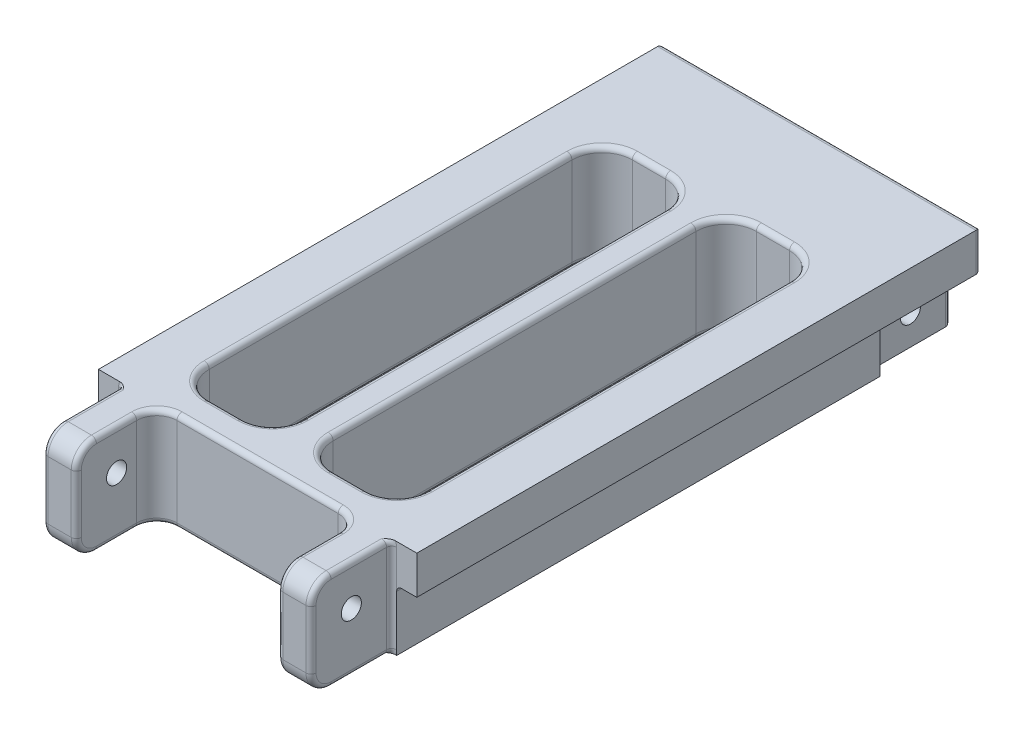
SolidWorks part; units mm, degrees
ref_plane "Front Plane" through (0, 0, 0) normal (0, 0, 1) x (1, 0, 0)
ref_plane "Top Plane" through (0, 0, 0) normal (0, 1, 0) x (1, 0, 0)
ref_plane "Right Plane" through (0, 0, 0) normal (1, 0, 0) x (0, 0, -1)
sketch "Sketch1" plane through (0, 0, 0) normal (0, 0, 1) x (1, 0, 0)
  line L24 (203.2, 0) -> (127, 0)
  line L25 (127, 0) -> (127, -76.2)
  line L26 (127, -76.2) -> (139.7, -76.2)
  line L27 (139.7, -76.2) -> (139.7, -101.6)
  line L28 (139.7, -101.6) -> (127, -101.6)
  line L29 (127, -101.6) -> (127, -139.7)
  line L30 (127, -139.7) -> (177.8, -139.7)
  line L31 (177.8, -139.7) -> (177.8, -101.6)
  line L32 (177.8, -101.6) -> (165.1, -101.6)
  line L33 (165.1, -101.6) -> (165.1, -76.2)
  line L34 (165.1, -76.2) -> (203.2, -76.2)
  line L35 (203.2, -76.2) -> (203.2, 0)
  line L36 (406.4, -76.2) -> (406.4, 0)
  line L37 (406.4, 0) -> (330.2, 0)
  line L38 (330.2, 0) -> (330.2, -76.2)
  line L39 (330.2, -76.2) -> (368.3, -76.2)
  line L40 (368.3, -76.2) -> (368.3, -101.6)
  line L41 (368.3, -101.6) -> (355.6, -101.6)
  line L42 (355.6, -101.6) -> (355.6, -139.7)
  line L43 (355.6, -139.7) -> (406.4, -139.7)
  line L44 (406.4, -139.7) -> (406.4, -101.6)
  line L45 (406.4, -101.6) -> (393.7, -101.6)
  line L46 (393.7, -101.6) -> (393.7, -76.2)
  line L47 (393.7, -76.2) -> (406.4, -76.2)
  line L48 (368.3, -76.2) -> (165.1, -76.2)
  line L49 (355.6, -139.7) -> (177.8, -139.7)
  line L50 (368.3, -74.93) -> (165.1, -74.93)
  line L51 (179.07, -139.7) -> (179.07, -100.33)
  line L52 (179.07, -100.33) -> (166.37, -100.33)
  line L53 (166.37, -100.33) -> (166.37, -76.2)
  line L54 (367.03, -76.2) -> (367.03, -100.33)
  line L55 (367.03, -100.33) -> (354.33, -100.33)
  line L56 (354.33, -100.33) -> (354.33, -139.7)
  line L57 (355.6, -138.43) -> (177.8, -138.43)
  dimension "D1" = 1.27
extrude "Boss-Extrude1" add sketch "Sketch1" against normal blind 406.4 contours L57 L56 L55 L54 L39 L48 L53 L52 L51
sketch "Sketch2" plane through (0, 0, 0) normal (0, 0, 1) x (1, 0, 0)
  line L0 (354.33, -138.43) -> (179.07, -138.43) construction
  line L1 (203.2, -138.43) -> (330.2, -138.43)
  line L2 (203.2, -138.43) -> (203.2, -76.2)
  line L3 (203.2, -76.2) -> (330.2, -76.2)
  line L4 (330.2, -138.43) -> (330.2, -76.2)
  line L5 (203.2, -138.43) -> (330.2, -76.2) construction
  line L6 (203.2, -76.2) -> (330.2, -138.43) construction
  line L7 (166.37, -76.2) -> (367.03, -76.2) construction
  line L8 (266.7, -138.43) -> (266.7, -76.2)
  line L9 (182.245, -138.43) -> (182.245, -76.2)
  line L10 (179.07, -138.43) -> (179.07, -100.33) construction
  line L11 (351.155, -138.43) -> (351.155, -76.2)
  point P4 (266.7, -107.315)
  dimension "D1" = 127
  dimension "D2" = 3.175
extrude "Cut-Extrude1" cut sketch "Sketch2" against normal blind 50.8 contours L8 L3 L2 M6 | L8 L1 L4 M10 | L11 M6 M7 M8 M9 M10 | L9 M6 M10 M11 M12 M13
sketch "Sketch3" plane through (330.2, 0, 0) normal (-1, 0, 0) x (0, 0, 1)
  line L2 (-50.8, -76.2) -> (0, -76.2) construction
  line L3 (0, -138.43) -> (0, -76.2) construction
  circle A0 centre (-25.4, -101.6) radius 6.35
  dimension "D1" = 12.7
  dimension "D2" = 25.4
  dimension "D3" = 25.4
extrude "Cut-Extrude2" cut sketch "Sketch3" against normal through all both and the other way through all
ref_plane "Plane1" through (266.7, 0, 0) normal (1, 0, 0) x (0, 0, -1)
sketch "Sketch4" plane through (266.7, 0, 0) normal (1, 0, 0) x (0, 0, -1)
  line L1 (406.4, -100.33) -> (381, -100.33)
  line L2 (406.4, -100.33) -> (406.4, -176.53)
  line L3 (406.4, -176.53) -> (381, -176.53)
  line L4 (381, -100.33) -> (381, -176.53)
  line L5 (406.4, -100.33) -> (381, -176.53) construction
  line L6 (406.4, -176.53) -> (381, -100.33) construction
  line L7 (406.4, -76.2) -> (50.8, -76.2) construction
  line L8 (361.95, -119.38) -> (361.95, -161.588)
  line L9 (361.95, -161.588) -> (381, -161.588)
  line L10 (381, -100.33) -> (420.5453, -100.33)
  line L11 (420.5453, -100.33) -> (395.8968, -131.2538)
  circle A0 centre (381, -119.38) radius 19.05
  point P4 (393.7, -138.43)
  dimension "D3" = 38.1
  dimension "D1" = 76.2
  dimension "D2" = 25.4
  dimension "D4" = 25.4
  dimension "D6" = 30.9238
extrude "Cut-Extrude3" cut sketch "Sketch4" against normal mid plane 127 contours L4 A0 | L2 A0 L4 | A0 L2 L1 | A0 L4 L3 L2 | A0 L8 L9 L4 | A0 L1 L2 L11 L10
sketch "Sketch5" plane through (0, -138.43, 0) normal (0, -1, 0) x (1, 0, 0)
  line L0 (179.07, -406.4) -> (179.07, -50.8) construction
  line L1 (185.42, -355.6) -> (347.98, -355.6)
  line L2 (185.42, -355.6) -> (185.42, -426.006)
  line L3 (185.42, -426.006) -> (347.98, -426.006)
  line L4 (347.98, -355.6) -> (347.98, -426.006)
  line L5 (185.42, -355.6) -> (347.98, -426.006) construction
  line L6 (185.42, -426.006) -> (347.98, -355.6) construction
  line L7 (354.33, -406.4) -> (354.33, -50.8) construction
  line L8 (203.2, -406.4) -> (179.07, -406.4) construction
  line L9 (125.262, -355.6) -> (402.4883, -355.6)
  line L10 (125.262, -355.6) -> (125.262, -438.4648)
  line L11 (125.262, -438.4648) -> (402.4883, -438.4648)
  line L12 (402.4883, -355.6) -> (402.4883, -438.4648)
  line L13 (125.262, -355.6) -> (402.4883, -438.4648) construction
  line L14 (125.262, -438.4648) -> (402.4883, -355.6) construction
  point P4 (266.7, -390.803)
  point P13 (263.8751, -397.0324)
  dimension "D1" = 6.35
  dimension "D2" = 6.35
  dimension "D3" = 50.8
extrude "Cut-Extrude5" cut sketch "Sketch5" along normal up to surface (38.1 mm away) contours L12 L9 L4 L3 L2 L10 L11 M9 M8 M20 M19 | L9 L4 M8 M9 | L9 L2 M19 M20
sketch "Sketch6" plane through (185.42, 0, 0) normal (-1, 0, 0) x (0, 0, 1)
  line L2 (-406.4, -100.33) -> (-381, -100.33) construction
  line L6 (-406.4, -100.33) -> (-381, -100.33)
  circle A1 centre (-381, -119.38) radius 19.05 construction
  circle A2 centre (-381, -119.38) radius 19.05
  circle A3 centre (-381, -119.38) radius 6.35
  dimension "D1" = 12.7
extrude "Cut-Extrude6" cut sketch "Sketch6" against normal blind 327.406 contours A3 | A2
fillet "Fillet1" radius 12.7 6 edges at (330.2, -107.315, -50.8) (203.2, -107.315, -50.8) (192.7225, -76.2, 0) (340.6775, -76.2, 0) (340.6775, -138.43, 0) (192.7225, -138.43, 0)
sketch "Sketch7" plane through (0, -138.43, 0) normal (0, -1, 0) x (1, 0, 0)
  line L0 (198.12, -50.8) -> (198.12, -355.6)
  line L1 (335.28, -355.6) -> (335.28, -50.8)
  line L2 (198.12, -355.6) -> (335.28, -355.6)
  line L3 (266.7, -355.6) -> (266.7, -50.8)
  line L4 (276.225, -355.6) -> (276.225, -50.8)
  line L5 (257.175, -355.6) -> (257.175, -50.8)
  line L6 (198.12, -336.55) -> (335.28, -336.55)
  line L7 (198.12, -50.8) -> (335.28, -50.8)
  line L8 (198.12, -69.85) -> (335.28, -69.85)
  line L20 (351.155, -50.8) -> (351.155, -12.7)
  line L21 (351.155, -12.7) -> (330.2, -12.7)
  line L22 (330.2, -12.7) -> (330.2, -38.1)
  line L23 (317.5, -50.8) -> (215.9, -50.8)
  line L24 (203.2, -38.1) -> (203.2, -12.7)
  line L25 (203.2, -12.7) -> (182.245, -12.7)
  line L26 (182.245, -12.7) -> (182.245, -50.8)
  line L27 (182.245, -50.8) -> (179.07, -50.8)
  line L28 (179.07, -50.8) -> (179.07, -355.6)
  line L29 (179.07, -355.6) -> (185.42, -355.6)
  line L30 (185.42, -355.6) -> (185.42, -406.4)
  line L31 (185.42, -406.4) -> (203.2, -406.4)
  line L32 (203.2, -406.4) -> (203.2, -361.95)
  line L33 (203.2, -361.95) -> (330.2, -361.95)
  line L34 (330.2, -361.95) -> (330.2, -406.4)
  line L35 (330.2, -406.4) -> (347.98, -406.4)
  line L36 (347.98, -406.4) -> (347.98, -355.6)
  line L37 (347.98, -355.6) -> (354.33, -355.6)
  line L38 (354.33, -355.6) -> (354.33, -50.8)
  line L39 (354.33, -50.8) -> (351.155, -50.8)
  line L40 (351.155, -50.8) -> (351.155, -12.7)
  line L41 (351.155, -12.7) -> (330.2, -12.7)
  line L42 (330.2, -12.7) -> (330.2, -38.1)
  line L43 (317.5, -50.8) -> (215.9, -50.8)
  line L44 (203.2, -38.1) -> (203.2, -12.7)
  line L45 (203.2, -12.7) -> (182.245, -12.7)
  line L46 (182.245, -12.7) -> (182.245, -50.8)
  line L47 (182.245, -50.8) -> (179.07, -50.8)
  line L48 (179.07, -50.8) -> (179.07, -355.6)
  line L49 (179.07, -355.6) -> (185.42, -355.6)
  line L50 (185.42, -355.6) -> (185.42, -406.4)
  line L51 (185.42, -406.4) -> (203.2, -406.4)
  line L52 (203.2, -406.4) -> (203.2, -361.95)
  line L53 (203.2, -361.95) -> (330.2, -361.95)
  line L54 (330.2, -361.95) -> (330.2, -406.4)
  line L55 (330.2, -406.4) -> (347.98, -406.4)
  line L56 (347.98, -406.4) -> (347.98, -355.6)
  line L57 (347.98, -355.6) -> (354.33, -355.6)
  line L58 (354.33, -355.6) -> (354.33, -50.8)
  line L59 (354.33, -50.8) -> (351.155, -50.8)
  arc A2 (317.5, -50.8) -> (330.2, -38.1) centre (317.5, -38.1) ccw
  arc A3 (203.2, -38.1) -> (215.9, -50.8) centre (215.9, -38.1) ccw
  arc A4 (317.5, -50.8) -> (330.2, -38.1) centre (317.5, -38.1) ccw
  arc A5 (203.2, -38.1) -> (215.9, -50.8) centre (215.9, -38.1) ccw
  dimension "D1" = 0
  dimension "D2" = 19.05
  dimension "D3" = 9.525
  dimension "D4" = 9.525
  dimension "D5" = 19.05
  dimension "D6" = 19.05
extrude "Cut-Extrude7" cut sketch "Sketch7" against normal blind 473.964 contours L8 L0 L6 L5 | L8 L4 L6 L1
fillet "Fillet2" radius 19.05 8 edges at (276.225, -107.315, -69.85) (335.28, -107.315, -69.85) (335.28, -107.315, -336.55) (276.225, -107.315, -336.55) (198.12, -107.315, -336.55) (257.175, -107.315, -336.55) (257.175, -107.315, -69.85) (198.12, -107.315, -69.85)
fillet "Fillet3" radius 3.175 32 edges at (203.6996, -76.2, -75.4296) (198.12, -76.2, -203.2) (203.6996, -76.2, -330.9704) (227.6475, -76.2, -336.55) (251.5954, -76.2, -330.9704) (257.175, -76.2, -203.2) (251.5954, -76.2, -75.4296) (335.28, -76.2, -203.2) (329.7004, -76.2, -330.9704) (305.7525, -76.2, -336.55) (281.8046, -76.2, -330.9704) (276.225, -76.2, -203.2) (281.8046, -76.2, -75.4296) (305.7525, -76.2, -69.85) (227.6475, -138.43, -69.85) (203.6996, -138.43, -75.4296) (198.12, -138.43, -203.2) (203.6996, -138.43, -330.9704) (227.6475, -138.43, -336.55) (251.5954, -138.43, -330.9704) (257.175, -138.43, -203.2) (276.225, -138.43, -203.2) (281.8046, -138.43, -330.9704) (305.7525, -138.43, -336.55) (329.7004, -138.43, -330.9704) (335.28, -138.43, -203.2) (329.7004, -138.43, -75.4296) (305.7525, -138.43, -69.85) (227.6475, -76.2, -69.85) (329.7004, -76.2, -75.4296) (251.5954, -138.43, -75.4296) (281.8046, -138.43, -75.4296)
fillet "Fillet4" radius 3.175 38 edges at (182.245, -76.2, -31.75) (182.245, -79.9197, -3.7197) (182.245, -107.315, 0) (182.245, -134.7103, -3.7197) (351.155, -76.2, -31.75) (351.155, -79.9197, -3.7197) (351.155, -107.315, 0) (351.155, -134.7103, -3.7197) (206.9197, -138.43, -47.0803) (203.2, -138.43, -25.4) (203.2, -134.7103, -3.7197) (203.2, -107.315, 0) (203.2, -79.9197, -3.7197) (203.2, -76.2, -25.4) (206.9197, -76.2, -47.0803) (266.7, -76.2, -50.8) (326.4803, -76.2, -47.0803) (330.2, -76.2, -25.4) (330.2, -79.9197, -3.7197) (330.2, -107.315, 0) (330.2, -134.7103, -3.7197) (330.2, -138.43, -25.4) (326.4803, -138.43, -47.0803) (367.03, -88.265, -406.4) (266.7, -76.2, -406.4) (166.37, -88.265, -406.4) (175.895, -100.33, -406.4) (185.42, -119.38, -406.4) (330.2, -119.38, -406.4) (203.2, -119.38, -406.4) (266.7, -100.33, -406.4) (339.09, -138.43, -406.4) (347.98, -119.38, -406.4) (357.505, -100.33, -406.4) (194.31, -138.43, -406.4) (182.245, -138.43, -31.75) (351.155, -138.43, -31.75) (266.7, -138.43, -50.8)
fillet "Fillet5" radius 3.175 20 edges at (331.1299, -99.4001, -405.4701) (203.2, -100.33, -392.1125) (330.2, -100.33, -392.1125) (330.2, -105.9096, -367.5296) (203.2, -105.9096, -367.5296) (202.2701, -99.4001, -405.4701) (350.2251, -137.5001, -50.8) (350.2251, -77.1299, -50.8) (183.1749, -137.5001, -50.8) (183.1749, -77.1299, -50.8) (182.245, -100.33, -355.6) (351.155, -100.33, -355.6) (347.98, -119.38, -355.6) (203.2, -128.905, -361.95) (330.2, -128.905, -361.95) (185.42, -119.38, -355.6) (351.155, -107.315, -50.8) (182.245, -107.315, -50.8) (179.07, -100.33, -203.2) (354.33, -100.33, -203.2)
sketch "Sketch8" plane through (0, -100.33, 0) normal (0, -1, 0) x (1, 0, 0)
  line L0 (333.375, -406.4) -> (200.025, -406.4) construction
  line L1 (266.7, -406.4) -> (266.7, -361.9686)
  line L2 (266.7, -19.2088) -> (266.7, 19.2088) construction
  circle A0 centre (266.7, -393.7) radius 1.524
  point P8 (265.5539, -393.7)
  point P9 (266.7, -393.7)
  dimension "D1" = 3.048
  dimension "D2" = 12.7
extrude "Cut-Extrude8" cut sketch "Sketch8" against normal blind 16.51 contours L1 A0 | L1 A0
chamfer "Chamfer1" distance 2.54 angle 45 1 edges at (266.7, -100.33, -395.224)
